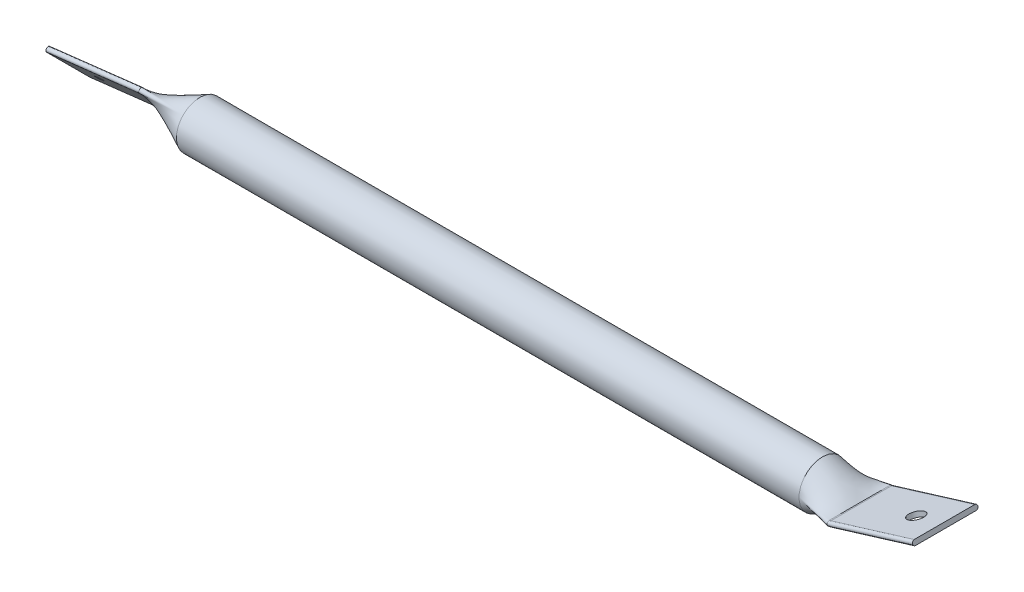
SolidWorks part; units mm, degrees
ref_plane "Front Plane" through (0, 0, 0) normal (0, 0, 1) x (1, 0, 0)
ref_plane "Top Plane" through (0, 0, 0) normal (0, 1, 0) x (1, 0, 0)
ref_plane "Right Plane" through (0, 0, 0) normal (1, 0, 0) x (0, 0, -1)
sketch "Sketch1" plane through (0, 0, 0) normal (1, 0, 0) x (0, 0, -1)
  circle A1 centre (0, 0) radius 23.9141
  dimension "D1" = 47.8282
extrude "Boss-Extrude1" add sketch "Sketch1" along normal mid plane 635
sketch "Sketch2" plane through (0, 0, 0) normal (0, 1, 0) x (1, 0, 0)
  line L0 (0, -33.3375) -> (0, 33.3375) construction
  line L1 (-355.6, 33.3375) -> (355.6, 33.3375)
  line L2 (-355.6, 33.3375) -> (-355.6, -33.3375)
  line L3 (-355.6, -33.3375) -> (355.6, -33.3375)
  line L4 (355.6, 33.3375) -> (355.6, -33.3375)
  line L5 (317.5, -23.9141) -> (317.5, 23.9141) construction
  dimension "D1" = 38.1
  dimension "D2" = 66.675
ref_plane "Plane1" through (355.6, 0, 0) normal (1, 0, 0) x (0, 0, -1)
sketch "Sketch3" plane through (355.6, 0, 0) normal (1, 0, 0) x (0, 0, -1)
  line L0 (-30.9245, 2.413) -> (30.9245, 2.413)
  line L1 (-30.9245, -2.413) -> (30.9245, -2.413)
  line L2 (0, 2.413) -> (0, -2.413) construction
  arc A0 (30.9245, 2.413) -> (30.9245, -2.413) centre (30.9245, 0) cw
  arc A1 (-30.9245, 2.413) -> (-30.9245, -2.413) centre (-30.9245, 0) ccw
  dimension "D1" = 4.826
sketch "Sketch4" plane through (317.5, 0, 0) normal (1, 0, 0) x (0, 0, -1)
  circle A1 centre (0, 0) radius 23.9141
  circle A2 centre (0, 0) radius 23.9141
  dimension "D1" = 0
loft "Loft1" add profiles "Sketch4", "Sketch3"
sketch "Sketch5" plane through (0, 0, 0) normal (0, 0, 1) x (1, 0, 0)
  line L0 (355.6, 2.413) -> (355.6, -2.413)
  line L1 (355.6, 2.413) -> (355.6, 7.239) construction
  line L2 (358.422, -1.9913) -> (355.6, 7.239) construction
  line L3 (357.011, 2.6239) -> (442.0265, 28.6157)
  line L4 (358.422, -1.9913) -> (443.4375, 24.0006)
  line L5 (443.4375, 24.0006) -> (442.0265, 28.6157)
  arc A0 (355.6, 2.413) -> (357.011, 2.6239) centre (355.6, 7.239) ccw
  arc A1 (355.6, -2.413) -> (358.422, -1.9913) centre (355.6, 7.239) ccw
  dimension "D2" = 4.826
  dimension "D1" = 17
  dimension "D3" = 88.9
extrude "Boss-Extrude2" add sketch "Sketch5" along normal up to vertex and the other way up to vertex
sketch "Sketch6" plane through (29.7841, -97.4194, 0) normal (-0.2924, 0.9563, 0) x (0.9563, 0.2924, 0)
  line L0 (400.9159, 0) -> (431.0784, 0) construction
  line L5 (431.0784, -30.9245) -> (431.0784, 30.9245) construction
  circle A0 centre (400.9159, 0) radius 7.9375
  dimension "D2" = 15.875
  dimension "D1" = 30.1625
extrude "Cut-Extrude1" cut sketch "Sketch6" against normal up to surface (4.826 mm away)
sketch "Sketch14" plane through (355.6, 0, 0) normal (1, 0, 0) x (0, 0, -1)
  line L1 (30.9245, 2.413) -> (30.9245, -2.413)
  line L2 (30.9245, 2.413) -> (30.9245, -2.413)
  arc A1 (30.9245, -2.413) -> (30.9245, 2.413) centre (30.9245, 0) ccw
  arc A2 (30.9245, -2.413) -> (30.9245, 2.413) centre (30.9245, 0) ccw
  dimension "D1" = 0
sketch "Sketch15" plane through (412.2424, 126.0351, 0) normal (0.9563, 0.2924, 0) x (0, 0, -1)
  line L0 (30.9245, -106.6967) -> (30.9245, -101.8707) construction
  line L1 (30.9245, -106.6967) -> (30.9245, -101.8707)
  arc A0 (30.9245, -101.8707) -> (30.9245, -106.6967) centre (30.9245, -104.2837) cw
sketch "Sketch16" plane through (0, 0, -30.9245) normal (0, 0, -1) x (-1, 0, 0)
  line L0 (-442.0265, 28.6157) -> (-357.011, 2.6239) construction
  line L1 (-442.0265, 28.6157) -> (-357.011, 2.6239)
  arc A0 (-357.011, 2.6239) -> (-355.6, 2.413) centre (-355.6, 7.239) ccw construction
  arc A1 (-357.011, 2.6239) -> (-355.6, 2.413) centre (-355.6, 7.239) ccw
sketch "Sketch17" plane through (0, 0, -30.9245) normal (0, 0, -1) x (-1, 0, 0)
  line L0 (-358.422, -1.9913) -> (-443.4375, 24.0006) construction
  line L1 (-358.422, -1.9913) -> (-443.4375, 24.0006)
  arc A0 (-358.422, -1.9913) -> (-355.6, -2.413) centre (-355.6, 7.239) ccw construction
  arc A1 (-358.422, -1.9913) -> (-355.6, -2.413) centre (-355.6, 7.239) ccw
loft "Loft3" add profiles "Sketch14", "Sketch15"
ref_plane "Plane2" through (-355.6, 0, 0) normal (-1, 0, 0) x (0, 0, 1)
sketch "Sketch7" plane through (-355.6, 0, 0) normal (-1, 0, 0) x (0, 0, 1)
  line L0 (21.8669, 21.8669) -> (-21.8669, -21.8669) construction
  line L1 (20.1607, 23.5732) -> (-23.5732, -20.1607)
  line L2 (23.5732, 20.1607) -> (-20.1607, -23.5732)
  line L3 (0, 0) -> (21.3211, 0) construction
  line L4 (-33.3375, 0) -> (33.3375, 0) construction
  arc A0 (20.1607, 23.5732) -> (23.5732, 20.1607) centre (21.8669, 21.8669) cw
  arc A1 (-23.5732, -20.1607) -> (-20.1607, -23.5732) centre (-21.8669, -21.8669) ccw
  dimension "D3" = 66.675
  dimension "D1" = 45
  dimension "D2" = 4.826
sketch "Sketch22" plane through (355.6, 0, 0) normal (1, 0, 0) x (0, 0, -1)
  line L1 (-30.9245, -2.413) -> (-30.9245, 2.413)
  line L2 (-30.9245, -2.413) -> (-30.9245, 2.413)
  arc A1 (-30.9245, 2.413) -> (-30.9245, -2.413) centre (-30.9245, 0) ccw
  arc A2 (-30.9245, 2.413) -> (-30.9245, -2.413) centre (-30.9245, 0) ccw
  dimension "D1" = 0
sketch "Sketch23" plane through (412.2424, 126.0351, 0) normal (0.9563, 0.2924, 0) x (0, 0, -1)
  line L0 (-30.9245, -106.6967) -> (-30.9245, -101.8707) construction
  line L1 (-30.9245, -106.6967) -> (-30.9245, -101.8707)
  arc A0 (-30.9245, -101.8707) -> (-30.9245, -106.6967) centre (-30.9245, -104.2837) ccw
sketch "Sketch24" plane through (0, 0, 30.9245) normal (0, 0, 1) x (1, 0, 0)
  line L0 (442.0265, 28.6157) -> (357.011, 2.6239) construction
  line L1 (442.0265, 28.6157) -> (357.011, 2.6239)
  arc A0 (355.6, 2.413) -> (357.011, 2.6239) centre (355.6, 7.239) ccw construction
  arc A1 (355.6, 2.413) -> (357.011, 2.6239) centre (355.6, 7.239) ccw
sketch "Sketch25" plane through (0, 0, 30.9245) normal (0, 0, 1) x (1, 0, 0)
  line L0 (358.422, -1.9913) -> (443.4375, 24.0006) construction
  line L1 (358.422, -1.9913) -> (443.4375, 24.0006)
  arc A0 (355.6, -2.413) -> (358.422, -1.9913) centre (355.6, 7.239) ccw construction
  arc A1 (355.6, -2.413) -> (358.422, -1.9913) centre (355.6, 7.239) ccw
loft "Loft5" add profiles "Sketch22", "Sketch23"
sketch "Sketch8" plane through (-317.5, 0, 0) normal (-1, 0, 0) x (0, 0, 1)
  circle A1 centre (0, 0) radius 23.9141
  circle A2 centre (0, 0) radius 23.9141
  dimension "D1" = 0
loft "Loft2" add profiles "Sketch8", "Sketch7"
sketch "Sketch11" plane through (-355.6, 0, 0) normal (-1, 0, 0) x (0, 0, 1)
  line L0 (-21.8669, -21.8669) -> (21.8669, 21.8669)
  line L1 (0, 0) -> (-18.7223, 18.7223)
  line L2 (20.1607, 23.5732) -> (-23.5732, -20.1607)
  line L3 (-20.1607, -23.5732) -> (23.5732, 20.1607)
  line L4 (20.1607, 23.5732) -> (-23.5732, -20.1607)
  line L5 (-20.1607, -23.5732) -> (23.5732, 20.1607)
  arc A2 (-23.5732, -20.1607) -> (-20.1607, -23.5732) centre (-21.8669, -21.8669) ccw
  arc A3 (23.5732, 20.1607) -> (20.1607, 23.5732) centre (21.8669, 21.8669) ccw
  arc A4 (-23.5732, -20.1607) -> (-20.1607, -23.5732) centre (-21.8669, -21.8669) ccw
  arc A5 (23.5732, 20.1607) -> (20.1607, 23.5732) centre (21.8669, 21.8669) ccw
  dimension "D1" = 0
ref_plane "Plane3" through (0, 0, 0) normal (0, -0.7071, -0.7071) x (-1, 0, 0)
sketch "Sketch12" plane through (0, 0, 0) normal (0, -0.7071, -0.7071) x (-1, 0, 0)
  line L0 (355.6, 2.413) -> (355.6, -2.413)
  line L2 (355.6, -7.239) -> (356.4412, 2.3763) construction
  line L3 (356.4412, 2.3763) -> (445.0029, -5.3719)
  line L4 (356.0206, -2.4314) -> (444.5823, -10.1795)
  line L5 (444.5823, -10.1795) -> (445.0029, -5.3719)
  line L6 (355.6, -2.413) -> (355.6, -7.239) construction
  arc A0 (355.6, 2.413) -> (356.4412, 2.3763) centre (355.6, -7.239) cw
  arc A1 (355.6, -2.413) -> (356.0206, -2.4314) centre (355.6, -7.239) cw
  dimension "D3" = 4.826
  dimension "D1" = 5
  dimension "D2" = 88.9
extrude "Boss-Extrude3" add sketch "Sketch12" along normal up to vertex and the other way up to vertex
sketch "Sketch13" plane through (-2.9139, 23.5508, -23.5508) normal (-0.0872, 0.7044, -0.7044) x (0.9962, 0.0616, -0.0616)
  line L0 (-413.6153, 0) -> (-443.7778, 0) construction
  line L1 (-443.7778, 30.9245) -> (-443.7778, -30.9245) construction
  circle A0 centre (-413.6153, 0) radius 3.9688
  dimension "D1" = 7.9375
  dimension "D2" = 30.1625
extrude "Cut-Extrude2" cut sketch "Sketch13" against normal up to surface (4.826 mm away)
sketch "Sketch18" plane through (-355.6, 0, 0) normal (-1, 0, 0) x (0, 0, 1)
  line L1 (-20.1607, -23.5732) -> (-23.5732, -20.1607)
  line L2 (-20.1607, -23.5732) -> (-23.5732, -20.1607)
  arc A1 (-23.5732, -20.1607) -> (-20.1607, -23.5732) centre (-21.8669, -21.8669) ccw
  arc A2 (-23.5732, -20.1607) -> (-20.1607, -23.5732) centre (-21.8669, -21.8669) ccw
  dimension "D1" = 0
sketch "Sketch19" plane through (-442.089, -27.3493, 27.3493) normal (-0.9962, -0.0616, 0.0616) x (0.0615, 0.0038, 0.9981)
  line L0 (-42.0983, -1.5584) -> (-45.5043, 1.8606) construction
  line L1 (-42.0983, -1.5584) -> (-45.5043, 1.8606)
  arc A0 (-45.5043, 1.8606) -> (-42.0983, -1.5584) centre (-43.8013, 0.1511) ccw
sketch "Sketch20" plane through (0, -21.8669, -21.8669) normal (0, -0.7071, -0.7071) x (1, 0, 0)
  line L0 (-445.0029, 5.3719) -> (-356.4412, -2.3763) construction
  line L1 (-445.0029, 5.3719) -> (-356.4412, -2.3763)
  arc A0 (-356.4412, -2.3763) -> (-355.6, -2.413) centre (-355.6, 7.239) ccw construction
  arc A1 (-356.4412, -2.3763) -> (-355.6, -2.413) centre (-355.6, 7.239) ccw
sketch "Sketch21" plane through (0, -21.8669, -21.8669) normal (0, -0.7071, -0.7071) x (1, 0, 0)
  line L0 (-356.0206, 2.4314) -> (-444.5823, 10.1795) construction
  line L1 (-356.0206, 2.4314) -> (-444.5823, 10.1795)
  arc A0 (-356.0206, 2.4314) -> (-355.6, 2.413) centre (-355.6, 7.239) ccw construction
  arc A1 (-356.0206, 2.4314) -> (-355.6, 2.413) centre (-355.6, 7.239) ccw
loft "Loft4" add profiles "Sketch18", "Sketch19"
sketch "Sketch26" plane through (-355.6, 0, 0) normal (-1, 0, 0) x (0, 0, 1)
  line L1 (20.1607, 23.5732) -> (23.5732, 20.1607)
  line L2 (20.1607, 23.5732) -> (23.5732, 20.1607)
  arc A1 (23.5732, 20.1607) -> (20.1607, 23.5732) centre (21.8669, 21.8669) ccw
  arc A2 (23.5732, 20.1607) -> (20.1607, 23.5732) centre (21.8669, 21.8669) ccw
  dimension "D1" = 0
sketch "Sketch27" plane through (-442.089, -27.3493, 27.3493) normal (-0.9962, -0.0616, 0.0616) x (0.0615, 0.0038, 0.9981)
  line L0 (1.7189, 42.092) -> (-1.6871, 45.511) construction
  line L1 (1.7189, 42.092) -> (-1.6871, 45.511)
  arc A0 (-1.6871, 45.511) -> (1.7189, 42.092) centre (0.0159, 43.8015) cw
sketch "Sketch28" plane through (0, 21.8669, 21.8669) normal (0, 0.7071, 0.7071) x (1, 0, 0)
  line L0 (-445.0029, -5.3719) -> (-356.4412, 2.3763) construction
  line L1 (-445.0029, -5.3719) -> (-356.4412, 2.3763)
  arc A0 (-355.6, 2.413) -> (-356.4412, 2.3763) centre (-355.6, -7.239) ccw construction
  arc A1 (-355.6, 2.413) -> (-356.4412, 2.3763) centre (-355.6, -7.239) ccw
sketch "Sketch29" plane through (0, 21.8669, 21.8669) normal (0, 0.7071, 0.7071) x (1, 0, 0)
  line L0 (-356.0206, -2.4314) -> (-444.5823, -10.1795) construction
  line L1 (-356.0206, -2.4314) -> (-444.5823, -10.1795)
  arc A0 (-355.6, -2.413) -> (-356.0206, -2.4314) centre (-355.6, -7.239) ccw construction
  arc A1 (-355.6, -2.413) -> (-356.0206, -2.4314) centre (-355.6, -7.239) ccw
loft "Loft6" add profiles "Sketch26", "Sketch27"
